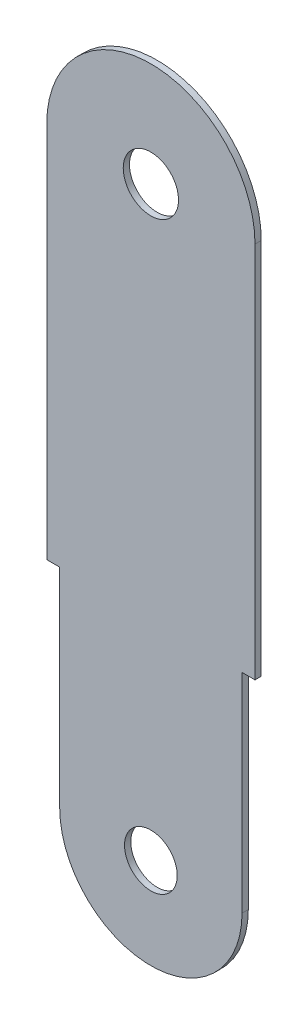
SolidWorks part; units mm, degrees
ref_plane "Front Plane" through (0, 0, 0) normal (0, 0, 1) x (1, 0, 0)
ref_plane "Top Plane" through (0, 0, 0) normal (0, 1, 0) x (1, 0, 0)
ref_plane "Right Plane" through (0, 0, 0) normal (1, 0, 0) x (0, 0, -1)
sketch "Sketch1" plane through (0, 0, 0) normal (0, 0, 1) x (1, 0, 0)
  line L0 (-59.4531, -177.9227) -> (-59.4531, -228.1619) construction
  line L1 (-34.0531, -35.0117) -> (-34.0531, -127.0741)
  line L2 (-84.8531, -35.0117) -> (-84.8531, -127.0741)
  line L4 (-34.0531, -127.0741) -> (-37.2113, -127.0741)
  line L5 (-84.8531, -127.0741) -> (-81.6948, -127.0741)
  line L6 (-37.2113, -127.0741) -> (-37.2113, -177.9227)
  line L8 (-81.6948, -127.0741) -> (-81.6948, -177.9227)
  circle A0 centre (-59.4531, -35.0117) radius 6.7437
  arc A1 (-34.0531, -35.0117) -> (-84.8531, -35.0117) centre (-59.4531, -35.0117) ccw
  arc A2 (-81.6948, -177.9227) -> (-37.2113, -177.9227) centre (-59.4531, -177.9227) ccw
  circle A3 centre (-59.4531, -177.9227) radius 6.4262
extrude "Boss-Extrude1" add sketch "Sketch1" along normal blind 1.524
